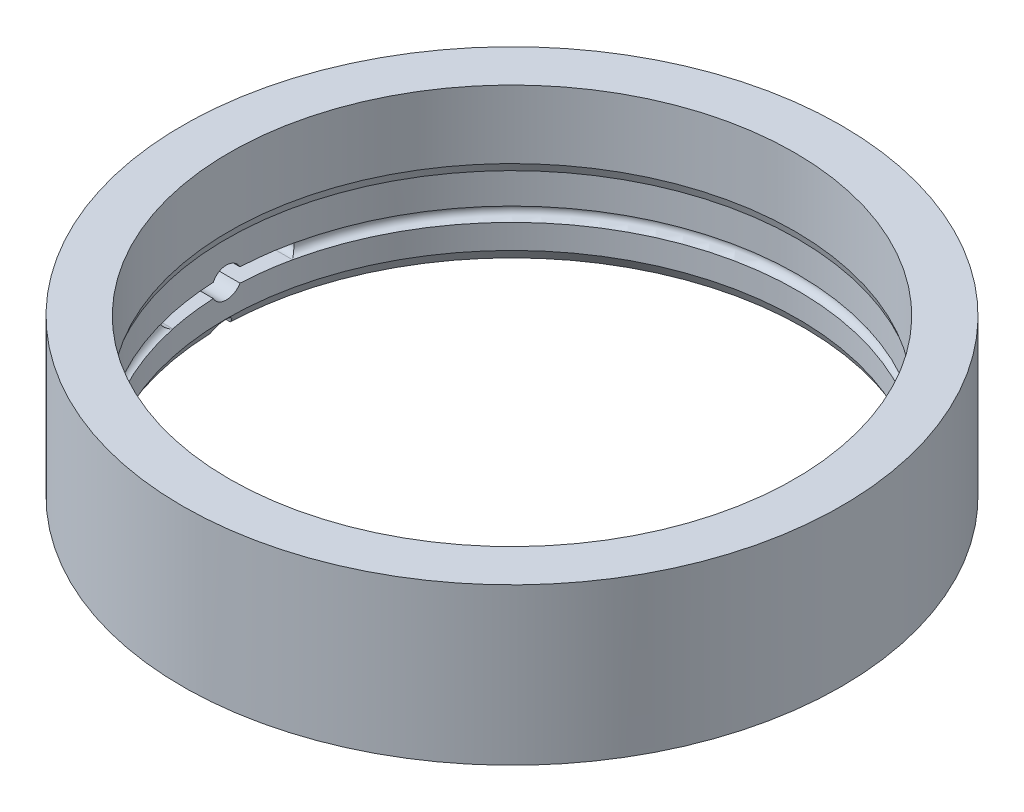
SolidWorks part; units mm, degrees
ref_plane "Front Plane" through (0, 0, 0) normal (0, 0, 1) x (1, 0, 0)
ref_plane "Top Plane" through (0, 0, 0) normal (0, 1, 0) x (1, 0, 0)
ref_plane "Right Plane" through (0, 0, 0) normal (1, 0, 0) x (0, 0, -1)
sketch "Sketch1" plane through (0, 0, 0) normal (0, 1, 0) x (1, 0, 0)
  circle A0 centre (0, 0) radius 83.185
  circle A1 centre (0, 0) radius 71.3486
  dimension "D1" = 166.37
  dimension "D2" = 142.6972
extrude "Boss-Extrude1" add sketch "Sketch1" along normal blind 29.2862
sketch "Sketch2" plane through (0, 29.2862, 0) normal (0, 1, 0) x (1, 0, 0)
  line L0 (0, 71.3486) -> (0, 83.185)
  circle A0 centre (0, 0) radius 71.3486 construction
  circle A1 centre (0, 0) radius 83.185 construction
ref_plane "Plane1" through (0, 0, 0) normal (1, 0, 0) x (0, 0, -1)
sketch "Sketch3" plane through (0, 29.2862, 0) normal (0, 1, 0) x (1, 0, 0)
  line L0 (0, 0) -> (-83.185, 0)
  circle A0 centre (0, 0) radius 83.185 construction
ref_plane "Plane2" through (0, 0, 0) normal (0, 0, -1) x (-1, 0, 0)
sketch "Sketch4" plane through (0, 0, 0) normal (0, 0, -1) x (-1, 0, 0)
  line L7 (0, 0) -> (0, 84.7913)
  line L8 (83.185, 29.2862) -> (-83.185, 29.2862) construction
  line L13 (72.1106, 0) -> (72.1106, 8.89)
  line L14 (-83.185, 0) -> (83.185, 0) construction
  line L15 (72.1106, 0) -> (71.3486, 0)
  line L16 (71.3486, 0) -> (71.3486, 29.2862)
  line L18 (71.3486, 0) -> (71.3486, 29.2862) construction
  line L21 (72.1106, 12.446) -> (72.1106, 29.2862)
  line L24 (72.1106, 29.2862) -> (71.3486, 29.2862)
  line L27 (72.1106, 12.446) -> (72.1106, 4.2487)
  circle A0 centre (72.1106, 10.668) radius 1.778
  point P10 (72.1106, 8.89)
  dimension "D1" = 72.1106
  dimension "D3" = 3.556
  dimension "D4" = 8.89
revolve "Cut-Revolve2" cut sketch "Sketch4" angle 360 about L7
sketch "Sketch7" plane through (0, 0, 0) normal (0, -1, 0) x (1, 0, 0)
  circle A0 centre (0, -1.5038) radius 84.6888
ref_plane "Plane3" through (-83.185, 0, 0) normal (-1, 0, 0) x (0, 0, 1)
sketch "Sketch8" plane through (-83.185, 0, 0) normal (-1, 0, 0) x (0, 0, 1)
  line L0 (0, 0) -> (0, 5.2578)
  line L1 (0, 45.7518) -> (0, -45.7518) construction
  line L2 (0, 5.2578) -> (-13.5636, 5.2578)
  line L3 (-86.1926, 0) -> (83.185, 0) construction
  circle A0 centre (-13.5636, 5.2578) radius 1.778
  dimension "D2" = 3.556
  dimension "D1" = 5.2578
  dimension "D3" = 13.5636
ref_plane "Plane5" through (0, 5.2578, 0) normal (0, -1, 0) x (-1, 0, 0)
sketch "Sketch10" plane through (0, 5.2578, 0) normal (0, -1, 0) x (-1, 0, 0)
  line L0 (83.185, 13.5636) -> (83.185, 15.3416)
  line L1 (83.185, 15.3416) -> (56.9551, 47.076)
  line L2 (56.9551, 47.076) -> (63.9351, 52.8453)
  circle A0 centre (0, 0) radius 73.892
  circle A1 centre (0, 0) radius 73.892
  dimension "D2" = 147.784
  dimension "D1" = 1.778
  dimension "D3" = 90
ref_plane "Plane6" through (0, 0, 0) normal (-0.6371, 0, 0.7708) x (-0.7708, 0, -0.6371)
chamfer "Chamfer1" distance 1.5875 angle 60 1 edges at (0, 0, -72.1106)
sketch "Sketch13" plane through (-83.185, 0, 0) normal (-1, 0, 0) x (0, 0, 1)
  line L0 (0, 0) -> (0, 29.2576)
  line L2 (3.81, 10.668) -> (3.81, 0)
  line L3 (-3.81, 10.668) -> (-3.81, 0)
  line L4 (-3.81, 0) -> (3.81, 0)
  line L5 (-83.185, 0) -> (83.185, 0) construction
  line L6 (-16.891, 10.668) -> (16.891, 10.668)
  line L7 (-16.891, 12.446) -> (16.891, 12.446)
  line L8 (-16.891, 12.446) -> (-16.891, 8.89)
  line L9 (-16.891, 8.89) -> (16.891, 8.89)
  line L10 (16.891, 12.446) -> (16.891, 8.89)
  line L11 (-16.891, 12.446) -> (16.891, 8.89) construction
  line L12 (-16.891, 8.89) -> (16.891, 12.446) construction
  circle A0 centre (0, 10.668) radius 3.81
  circle A1 centre (-15.113, 10.668) radius 1.778
  circle A2 centre (15.113, 10.668) radius 1.778
  circle A3 centre (0, 0) radius 2.54
  point P10 (0, 6.858)
  dimension "D1" = 7.62
  dimension "D5" = 5.08
  dimension "D2" = 33.782
  dimension "D3" = 3.556
  dimension "D4" = 8.89
extrude "Cut-Extrude3" cut sketch "Sketch13" against normal up to surface (11.1191 mm away) contours L6 A0 L9 L0 | L9 A0 L6 L0 | L6 A0 L7 L0 | L7 A0 L6 L0 | A1 L6 A0 L7 | A1 L9 L3 L6 | A0 L3 L9 | A0 L9 L2 | A2 L7 A0 L6 | A2 L6 L2 L9 | L6 A2 | L6 A2 | L6 A1 | L6 A1 | L0 A3 L4 | L4 A3 L0 | L0 A0 L7 | L7 A0 L0 | L9 A0 L0 | L0 A0 L9
ref_plane "Plane7" through (0, -90.7068, 0) normal (0, -1, 0) x (-1, 0, 0)
sketch "Sketch14" plane through (0, 29.2862, 0) normal (0, 1, 0) x (1, 0, 0)
  circle A0 centre (0, 0) radius 83.185
  circle A1 centre (0, 0) radius 72.1106
  circle A2 centre (0, 0) radius 83.185 construction
  circle A3 centre (0, 0) radius 72.1106 construction
extrude "Boss-Extrude2" add sketch "Sketch14" along normal blind 10.16
sketch "Sketch18" plane through (0, 0, 0) normal (0, -1, 0) x (1, 0, 0)
  line L0 (0, 0) -> (0, 82.7757)
sketch "Sketch20" plane through (0, 0, 0) normal (-1, 0, 0) x (0, 0, 1)
  line L0 (-72.1106, 12.446) -> (-72.1106, 39.4462)
  line L1 (-72.1106, 39.4462) -> (-71.3525, 39.4462)
  line L2 (83.185, 39.4462) -> (-83.185, 39.4462) construction
  line L3 (-71.3525, 39.4462) -> (-71.3525, 22.2758)
  line L4 (-71.3525, 22.2758) -> (-72.1106, 20.193)
  line L5 (-83.185, 0) -> (83.185, 0) construction
  line L6 (-71.3525, 39.4462) -> (-72.1106, 39.4462)
  line L7 (0, 0) -> (0, -40.439)
  point P14 (-72.1106, 10.668)
  dimension "D4" = 10.668
  dimension "D1" = 20
  dimension "D2" = 2.0828
  dimension "D3" = 20.193
revolve "Revolve2" add sketch "Sketch20" angle 360 about L7
